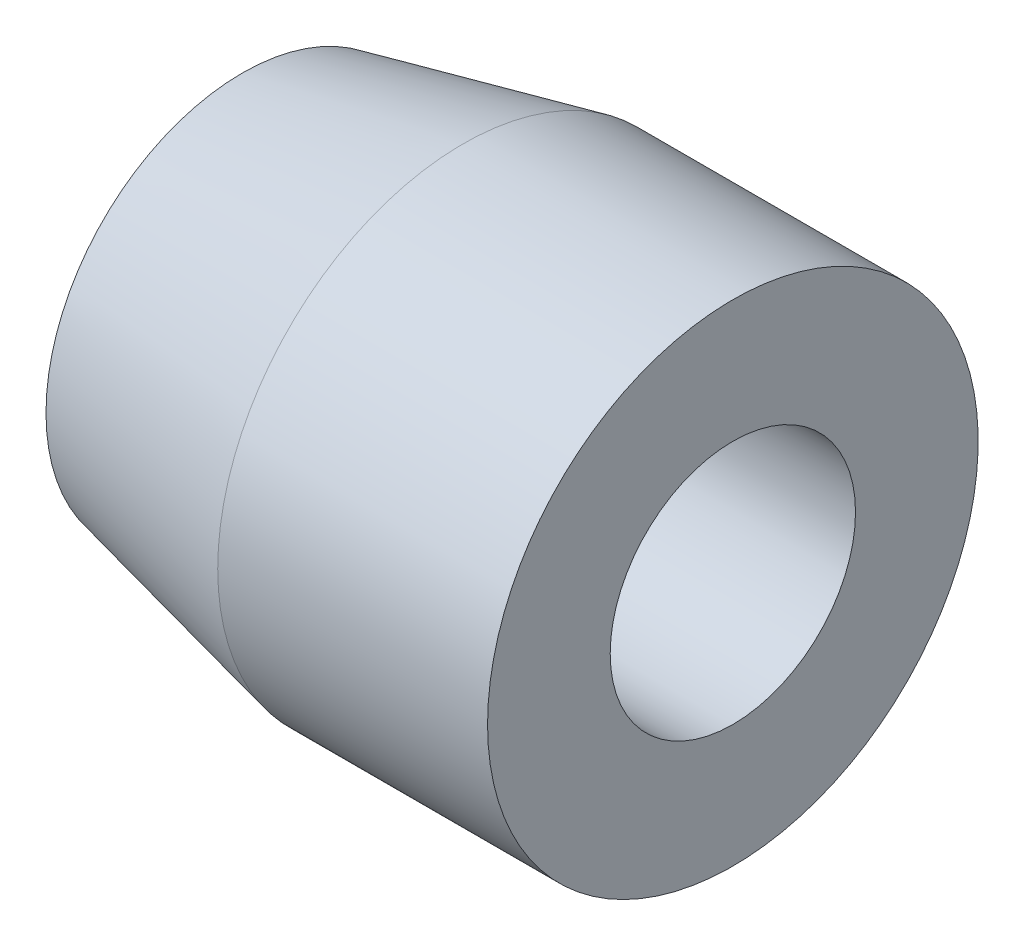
SolidWorks part; units mm, degrees
ref_plane "face" through (0, 0, 0) normal (0, 0, 1) x (1, 0, 0)
ref_plane "dessus" through (0, 0, 0) normal (0, 1, 0) x (1, 0, 0)
ref_plane "droite" through (0, 0, 0) normal (1, 0, 0) x (0, 0, -1)
sketch "Esquisse1" plane through (0, 0, 0) normal (0, 0, 1) x (1, 0, 0)
  line L0 (-40, 5) -> (70, 5) construction
  line L1 (0, 0) -> (-5.5, 0)
  line L2 (-5.5, 0) -> (-10, 1)
  line L3 (-10, 1) -> (-10, 5)
  line L4 (0, 0) -> (0, 5)
  line L5 (-10, 5) -> (0, 5)
  dimension "D1" = 4
  dimension "D2" = 4.5
  dimension "D3" = 5.5
  dimension "D4" = 5
revolve "Base-Révolution" add sketch "Esquisse1" angle 360 about L0
sketch "Esquisse3" plane through (0, 0, 0) normal (1, 0, 0) x (0, 0, -1)
  circle A0 centre (0, 5) radius 2.5
  dimension "D1" = 5
  dimension "D2" = 5
extrude "Enlèv. mat.-Extru.2" cut sketch "Esquisse3" against normal blind 7
sketch "Esquisse4" plane through (-10, 0, 0) normal (-1, 0, 0) x (0, 0, 1)
  line L4 (-1.7875, 7.9419) -> (1.7125, 7.9419)
  line L7 (1.7125, 7.9419) -> (3.4625, 4.9108)
  line L8 (3.4625, 4.9108) -> (1.7125, 1.8797)
  line L9 (1.7125, 1.8797) -> (-1.7875, 1.8797)
  line L10 (-3.9868, -0.7626) -> (-3.9868, 20.5152) construction
  line L11 (-10, -0.7616) -> (15.3131, -0.7616) construction
  line L12 (-1.7875, 1.8797) -> (-3.5375, 4.9108)
  line L13 (-3.5375, 4.9108) -> (-1.7875, 7.9419)
  dimension "D1" = 3.5
  dimension "D2" = 3.5
  dimension "D3" = 3.5
  dimension "D4" = 3.5
  dimension "D5" = 3.5
  dimension "D6" = 3.5
  dimension "D7" = 240
  dimension "D8" = 240
  dimension "D10" = 0.001
extrude "Enlèv. mat.-Extru.4" cut sketch "Esquisse4" against normal blind 3
